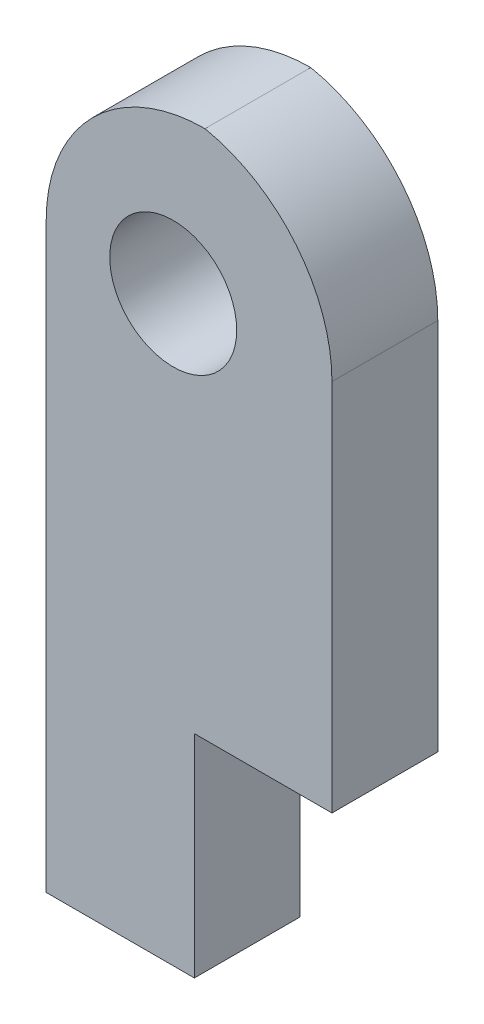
SolidWorks part; units mm, degrees
ref_plane "Plan de face" through (0, 0, 0) normal (0, 0, 1) x (1, 0, 0)
ref_plane "Plan de dessus" through (0, 0, 0) normal (0, 1, 0) x (1, 0, 0)
ref_plane "Plan de droite" through (0, 0, 0) normal (1, 0, 0) x (0, 0, -1)
sketch "Esquisse1" plane through (0, 0, 0) normal (0, 0, 1) x (1, 0, 0)
  line L0 (-27, 0) -> (-13, 0)
  line L1 (-27, 0) -> (-27, 70)
  line L2 (-27, 70) -> (0, 70)
  line L3 (-13, 0) -> (-13, 20)
  line L4 (-13, 20) -> (0, 20)
  line L5 (0, 20) -> (0, 70)
  circle A0 centre (-15, 55) radius 6
  dimension "D4" = 12
  dimension "D1" = 14
  dimension "D2" = 70
  dimension "D3" = 20
extrude "Extrusion1" add sketch "Esquisse1" along normal blind 10
fillet "Congé1" radius 15 1 edges at (-27, 70, 5)
fillet "Congé2" radius 15 1 edges at (0, 70, 5)
